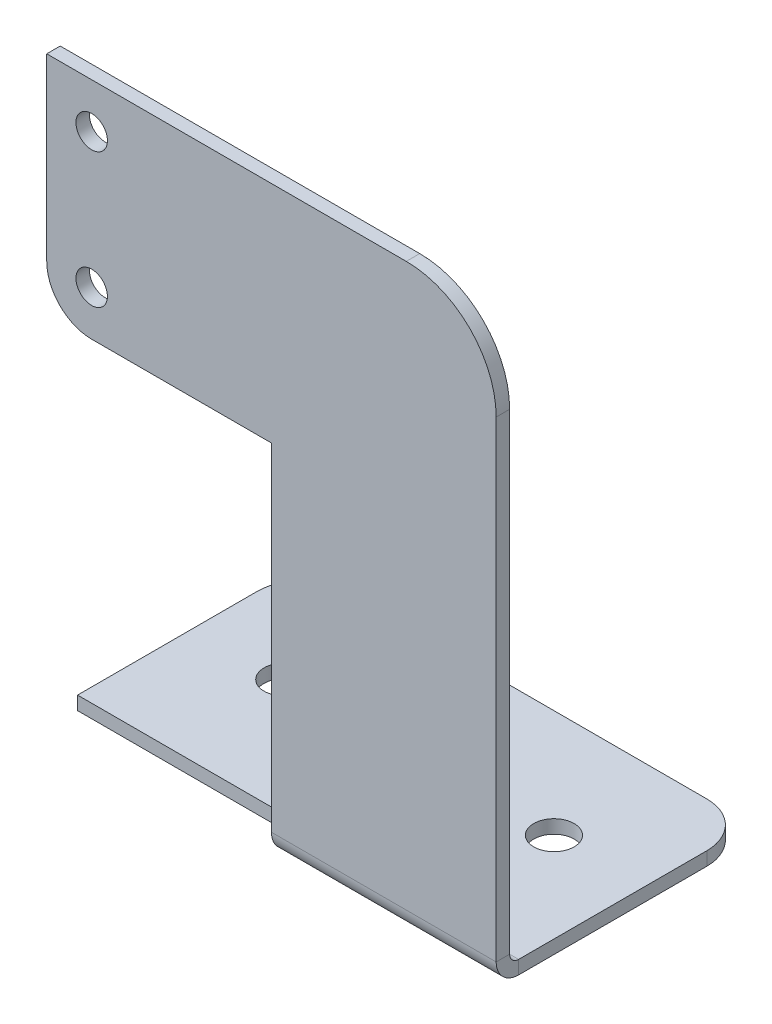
SolidWorks part; units mm, degrees
ref_plane "Front Plane" through (0, 0, 0) normal (0, 0, 1) x (1, 0, 0)
ref_plane "Top Plane" through (0, 0, 0) normal (0, 1, 0) x (1, 0, 0)
ref_plane "Right Plane" through (0, 0, 0) normal (1, 0, 0) x (0, 0, -1)
sketch "Sketch1" plane through (0, 0, 0) normal (0, 0, 1) x (1, 0, 0)
  line L0 (5, 0) -> (45, 0)
  line L1 (50, 5) -> (50, 80)
  line L2 (40, 90) -> (0, 90)
  line L3 (0, 90) -> (0, 70)
  line L4 (5, 65) -> (25, 65)
  line L5 (25, 65) -> (25, 25)
  line L6 (25, 25) -> (0, 25)
  line L7 (0, 25) -> (0, 5)
  circle A0 centre (5, 85) radius 1.75
  circle A1 centre (5, 70) radius 1.75
  circle A2 centre (10, 12) radius 2.25
  circle A3 centre (40, 12) radius 2.25
  arc A4 (5, 0) -> (0, 5) centre (5, 5) cw
  arc A5 (45, 0) -> (50, 5) centre (45, 5) ccw
  arc A6 (5, 65) -> (0, 70) centre (5, 70) cw
  arc A7 (50, 80) -> (40, 90) centre (40, 80) ccw
  point P19 (0, 0)
  point P24 (0, 65)
  point P27 (50, 90)
  dimension "D6" = 4.5
  dimension "D7" = 3.5
  dimension "D8" = 12
  dimension "D9" = 12
  dimension "D10" = 10
  dimension "D11" = 10
  dimension "D12" = 5
  dimension "D13" = 5
  dimension "D14" = 15
  dimension "D15" = 5
  dimension "D16" = 5
  dimension "D17" = 10
  dimension "D1" = 50
  dimension "D2" = 25
  dimension "D3" = 40
  dimension "D4" = 25
  dimension "D5" = 25
sheet metal parameters "Sheet-Metal1" thickness 1.5 parameters "D1"=1
base flange "Base-Flange1" sketch "Sketch1" thickness 1.5 reverse thickness direction yes parameters "D1"=1
sketch "Sketch3" plane through (0, 0, 1.5) normal (0, 0, 1) x (1, 0, 0)
  line L0 (25, 25) -> (50, 25)
  line L1 (50, 5) -> (50, 80) construction
sketched bend "Sketched Bend1" parameters "D1"=1
bend "SketchBend1" bend radius 1 bend angle 90 parameters "D5"=1
flat pattern "Flat-Pattern1"
sketch "Bend-Lines1" plane through (0, 0, 0) normal (0, 1, 0) x (-1, 0, 0)
bend of the flat pattern "Flatten-<SketchBend1>1"
